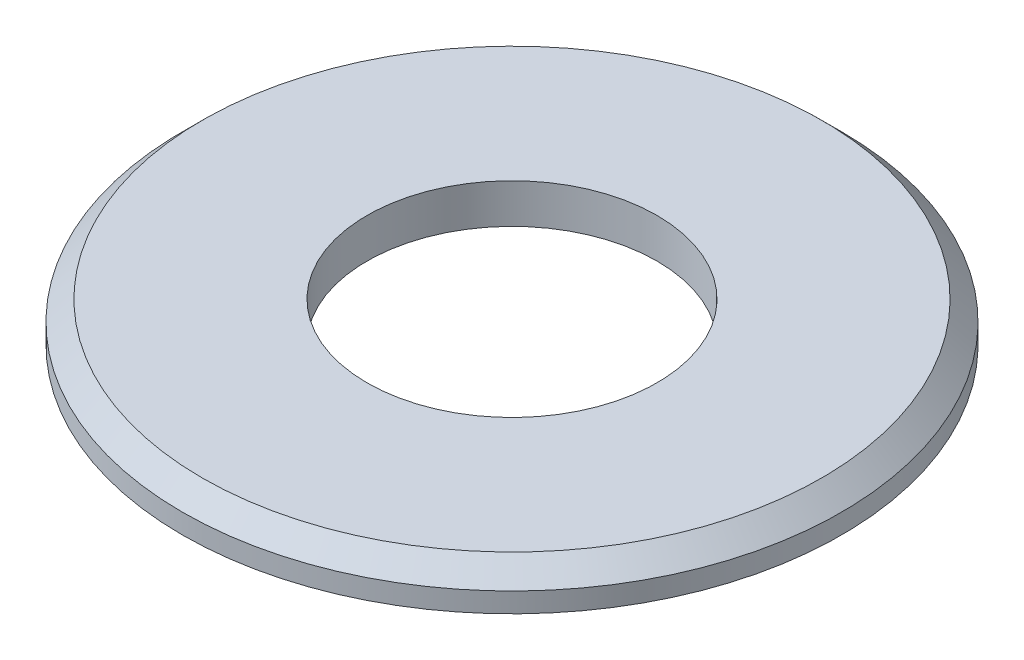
SolidWorks part; units mm, degrees
ref_plane "Front" through (0, 0, 0) normal (0, 0, 1) x (1, 0, 0)
ref_plane "Top" through (0, 0, 0) normal (0, 1, 0) x (1, 0, 0)
ref_plane "Right" through (0, 0, 0) normal (1, 0, 0) x (0, 0, -1)
sketch "Sketch1" plane through (0, 0, 0) normal (0, 1, 0) x (1, 0, 0)
  circle A0 centre (0, 0) radius 1.1
  circle A1 centre (0, 0) radius 2.5
extrude "Extrude1" add sketch "Sketch1" along normal blind 0.3
chamfer "Chamfer1" distance 0.15 1 edges at (0, 0.3, 2.5)
